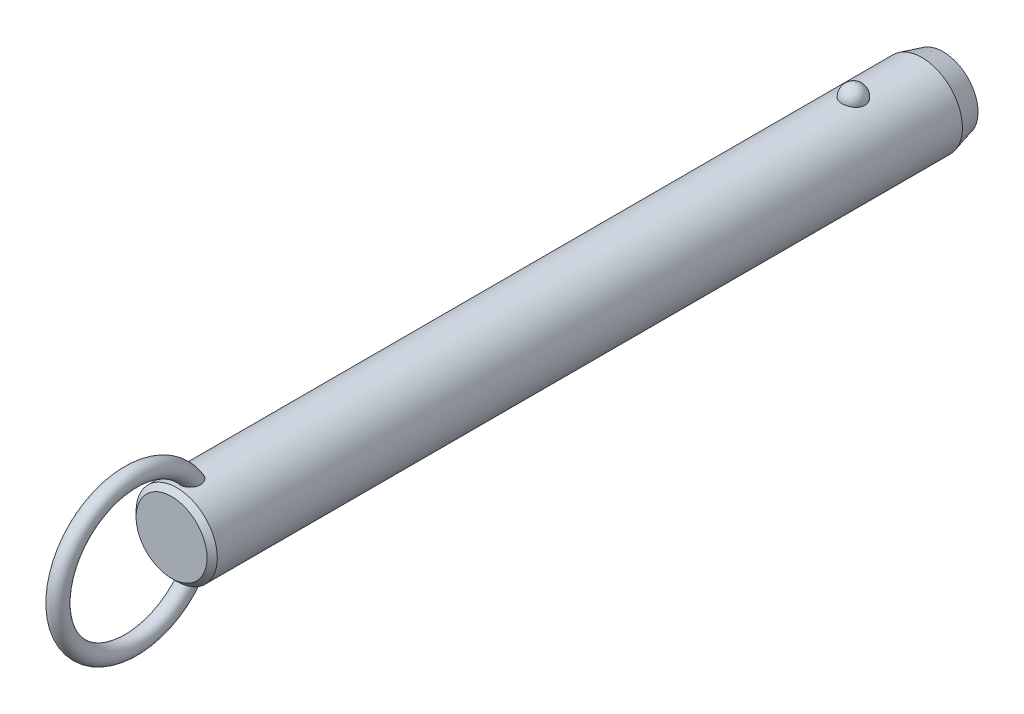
SolidWorks part; units mm, degrees
ref_plane "Front Plane" through (0, 0, 0) normal (0, 0, 1) x (1, 0, 0)
ref_plane "Top Plane" through (0, 0, 0) normal (0, 1, 0) x (1, 0, 0)
ref_plane "Right Plane" through (0, 0, 0) normal (1, 0, 0) x (0, 0, -1)
sketch "Sketch2" plane through (0, 0, 0) normal (0, 0, 1) x (1, 0, 0)
  circle A0 centre (0, 0) radius 9.5
  point P3 (0, 9.5)
  dimension "D1" = 19
extrude "Boss-Extrude1" add sketch "Sketch2" along normal blind 147.3
sketch "Sketch3" plane through (0, 0, 0) normal (0, 0, -1) x (-1, 0, 0)
  circle A0 centre (0, 0) radius 9.5
  dimension "D1" = 19
extrude "Boss-Extrude2" add sketch "Sketch3" along normal blind 23.7
chamfer "Chamfer1" distance 5 angle 15 1 edges at (-9.5, 0, -23.7)
sketch "Sketch12" plane through (0, 0, 0) normal (1, 0, 0) x (0, 0, -1)
  line L0 (-147.3, 9.5) -> (-147.3, -9.5) construction
  point P0 (-147.3, 0)
sketch "Sketch13" plane through (0, 0, 0) normal (1, 0, 0) x (0, 0, -1)
  circle A0 centre (-166.35, 0) radius 19.05
  point P2 (-147.3, 0)
  dimension "D1" = 38.1
sketch "Sketch14" plane through (0, 0, 0) normal (0, 1, 0) x (1, 0, 0)
  circle A0 centre (0, -149.3) radius 2
  point P2 (0, -147.3)
  dimension "D1" = 4
sweep "Sweep1" add profiles "Sketch14" path "Sketch13"
sketch "Sketch15" plane through (0, 0, 147.3) normal (0, 0, 1) x (1, 0, 0)
  circle A0 centre (0, 0) radius 9.5
  dimension "D1" = 19
extrude "Boss-Extrude3" add sketch "Sketch15" along normal blind 9.52
chamfer "Chamfer2" distance 1.2 angle 45 1 edges at (9.5, 0, 156.82)
sketch "Sketch18" plane through (0, 0, 0) normal (1, 0, 0) x (0, 0, -1)
  line L0 (18.7, 9.5) -> (-149.8378, 9.5) construction
  line L1 (2.7, 12.2) -> (2.7, 6.8)
  line L2 (-149.8378, -9.5) -> (18.7, -9.5) construction
  arc A0 (2.7, 12.2) -> (2.7, 6.8) centre (2.7, 9.5) ccw
  point P4 (0, 9.5)
  dimension "D1" = 21.7
revolve "Revolve1" add sketch "Sketch18" angle 360 about L1
